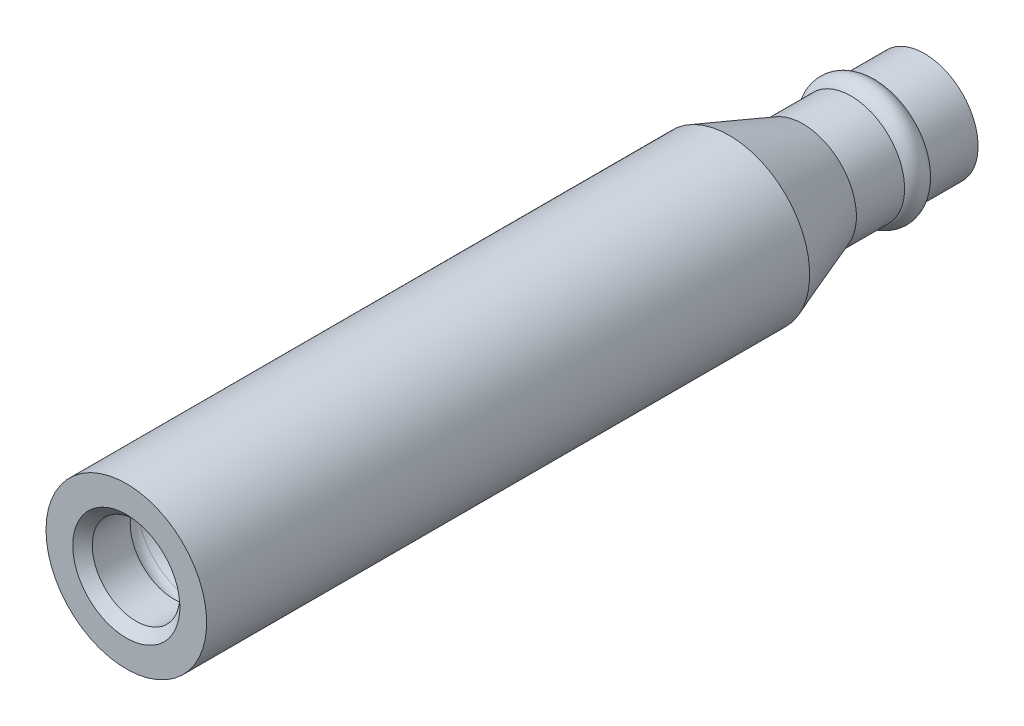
SolidWorks part; units mm, degrees
ref_plane "FRONT" through (0, 0, 0) normal (0, 0, 1) x (1, 0, 0)
ref_plane "TOP" through (0, 0, 0) normal (0, 1, 0) x (1, 0, 0)
ref_plane "RIGHT" through (0, 0, 0) normal (1, 0, 0) x (0, 0, -1)
sketch "Sketch1" plane through (0, 0, 0) normal (1, 0, 0) x (0, 0, -1)
  line L0 (-20.828, 2.794) -> (-20.828, 4.191)
  line L1 (-20.828, 4.191) -> (10.6398, 4.191)
  line L2 (10.6398, 4.191) -> (14.478, 2.794)
  line L3 (14.478, 2.794) -> (16.9931, 2.794)
  line L4 (20.828, 2.794) -> (20.828, 0.635)
  line L5 (16.129, 0) -> (-16.129, 0) construction
  line L6 (20.828, 0.635) -> (8.128, 0.635)
  line L7 (8.128, 0.635) -> (8.128, 1.7526)
  line L8 (8.128, 1.7526) -> (2.032, 1.7526)
  line L9 (2.032, 1.7526) -> (2.032, 2.6924)
  line L10 (2.032, 2.6924) -> (-12.446, 2.6924)
  line L11 (-12.446, 2.6924) -> (-12.446, 2.286)
  line L12 (-12.446, 2.286) -> (-15.7738, 2.286)
  line L13 (-20.828, 2.794) -> (-20.32, 2.286)
  line L14 (-20.32, 2.286) -> (-18.3388, 2.286)
  line L15 (-17.2548, 2.9766) -> (-15.7738, 2.286)
  line L16 (18.3129, 2.794) -> (20.828, 2.794)
  arc A0 (-18.3388, 2.286) -> (-17.2548, 2.9766) centre (-17.5768, 2.286) cw
  arc A1 (18.3129, 2.794) -> (16.9931, 2.794) centre (17.653, 2.413) ccw
  dimension "D8" = 0.762
  dimension "D20" = 0.762
  dimension "D21" = 6.35
  dimension "D1" = 5.588
  dimension "D2" = 8.382
  dimension "D3" = 41.656
  dimension "D4" = 6.35
  dimension "D5" = 20
  dimension "D6" = 1.27
  dimension "D7" = 20.828
  dimension "D9" = 3.5052
  dimension "D10" = 5.3848
  dimension "D11" = 4.572
  dimension "D12" = 5.1308
  dimension "D13" = 14.478
  dimension "D14" = 25
  dimension "D15" = 0.508
  dimension "D16" = 45
  dimension "D17" = 22.86
  dimension "D18" = 6.096
  dimension "D19" = 3.175
revolve "Revolve1" add sketch "Sketch1" angle 360 about L5
